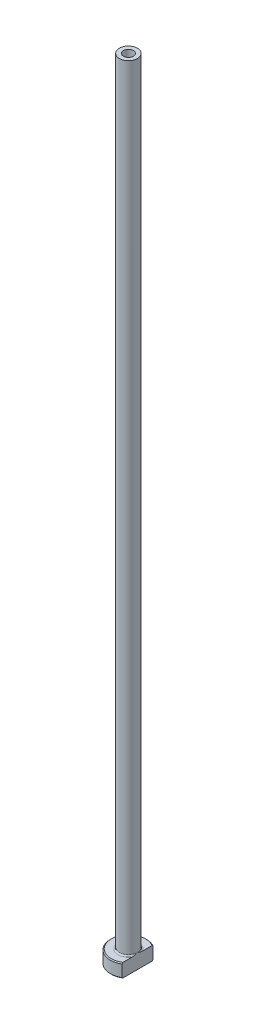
SolidWorks part; units mm, degrees
ref_plane "Front Plane" through (0, 0, 0) normal (0, 0, 1) x (1, 0, 0)
ref_plane "Top Plane" through (0, 0, 0) normal (0, 1, 0) x (1, 0, 0)
ref_plane "Right Plane" through (0, 0, 0) normal (1, 0, 0) x (0, 0, -1)
sketch "Sketch1" plane through (0, 0, 0) normal (0, 0, 1) x (1, 0, 0)
  line L0 (-1.1, 175) -> (-2, 175)
  line L1 (-2, 175) -> (-2, 3)
  line L2 (-2, 3) -> (-4, 3)
  line L3 (-4, 3) -> (-4, 0)
  line L4 (3.3, 0) -> (-3.3, 0) construction
  line L5 (-4, 0) -> (-1.35, 0)
  line L6 (-1.1, 140) -> (-1.1, 175)
  line L7 (0, 92.1877) -> (0, -15.5353) construction
  line L8 (0, -4.4) -> (0, 4.4) construction
  line L9 (-1.1, 140) -> (-1.35, 128)
  line L10 (-1.35, 128) -> (-1.35, 0)
  dimension "D1" = 0.25
  dimension "ID" = 2.2
  dimension "OD" = 4
  dimension "L" = 175
  dimension "H" = 8
  dimension "T" = 3
  dimension "N" = 35
  dimension "D2" = 12
  dimension "L-N" = 140
revolve "Revolve1" add sketch "Sketch1" angle 360 about L7
fillet "Fillet1" radius 0.3 1 edges at (0, 3, 2)
chamfer "Chamfer1" distance 0.2 angle 45 2 edges at (0, 3, 4) (0, 0, 4)
sketch "Sketch2" plane through (0, 0, 0) normal (0, -1, 0) x (1, 0, 0)
  line L0 (2, 3.4641) -> (2, -3.4641)
  circle A0 centre (0, 0) radius 4 construction
  arc A1 (2, 3.4641) -> (2, -3.4641) centre (0, 0) cw
  circle A2 centre (0, 0) radius 2 construction
extrude "Cut-Extrude1" cut sketch "Sketch2" against normal through all
chamfer "Chamfer2" distance 0.5 angle 45 1 edges at (0, 0, 1.35)
